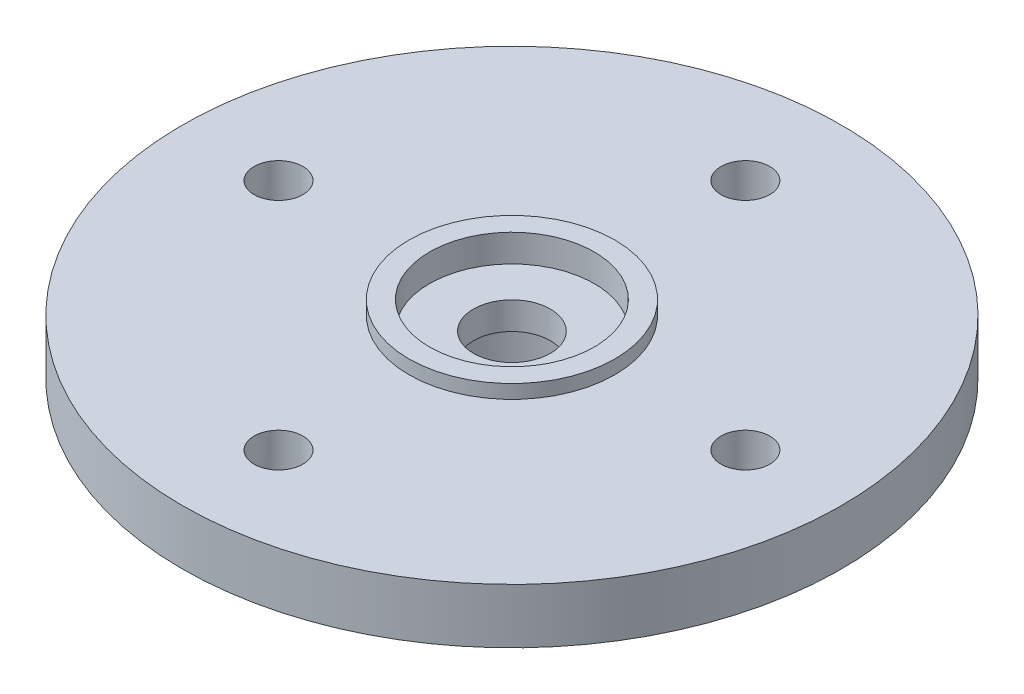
SolidWorks part; units mm, degrees
ref_plane "Front Plane" through (0, 0, 0) normal (0, 0, 1) x (1, 0, 0)
ref_plane "Top Plane" through (0, 0, 0) normal (0, 1, 0) x (1, 0, 0)
ref_plane "Right Plane" through (0, 0, 0) normal (1, 0, 0) x (0, 0, -1)
sketch "Sketch1" plane through (0, 0, 0) normal (0, 0, 1) x (1, 0, 0)
  line L0 (0, 0) -> (0, -4.5) construction
  line L1 (0, -55) -> (0, 55) construction
  line L2 (55, 0) -> (-55, 0) construction
  line L3 (-12, 0) -> (-3.75, 0)
  line L4 (-12, 0) -> (-12, -2)
  line L5 (-12, -2) -> (-4.5, -2)
  line L6 (-1.4, 0.5) -> (-1.4, -4.5)
  line L8 (-4.5, -2) -> (-4.5, -4.5)
  line L9 (-4.5, -4.5) -> (-1.4, -4.5)
  line L10 (-3.75, 0.5) -> (-1.4, 0.5)
  line L11 (-3.75, 0.5) -> (-3.75, 0)
  dimension "D1" = 9
  dimension "D2" = 2.5
  dimension "D3" = 4.5
  dimension "D4" = 24
  dimension "D5" = 2.8
  dimension "D6" = 7.5
  dimension "D7" = 5
revolve "Revolve1" add sketch "Sketch1" angle 360 about L0
hole_wizard "#2-56 Tapped Hole1" positions "Sketch3" profile "Sketch2" tap size "#2-56" standard "Ansi Inch"
sketch "Sketch3" plane through (0, 0, 0) normal (0, 1, 0) x (-1, 0, 0)
  circle A0 centre (0, 0) radius 8.5 construction
  point P0 (0, -8.5)
  point P1 (8.5, 0)
  point P3 (-8.5, 0)
  point P5 (0, 8.5)
  dimension "D1" = 17
sketch "Sketch2" plane through (0, 0, -8.5) normal (1, 0, 0) x (0, 0, 1)
  line L0 (0, 0) -> (0, 2)
  line L1 (0, 2) -> (0.889, 2)
  line L2 (0.889, 2) -> (0.889, 0)
  line L5 (0.889, 0) -> (0, 0)
  line L11 (0, -6.35) -> (0, 107.95) construction
  dimension "Thru Tap Drill Dia." = 1.778
  dimension "Thru Tap Drill Depth" = 2
sketch "Sketch4" plane through (0, 0.5, 0) normal (0, 1, 0) x (-1, 0, 0)
  circle A0 centre (0, 0) radius 3
  dimension "D1" = 6
extrude "Cut-Extrude1" cut sketch "Sketch4" against normal blind 1
sketch "Sketch5" plane through (0, -4.5, 0) normal (0, -1, 0) x (1, 0, 0)
  circle A0 centre (0, 0) radius 3
  dimension "D1" = 6
extrude "Cut-Extrude2" cut sketch "Sketch5" against normal blind 3
